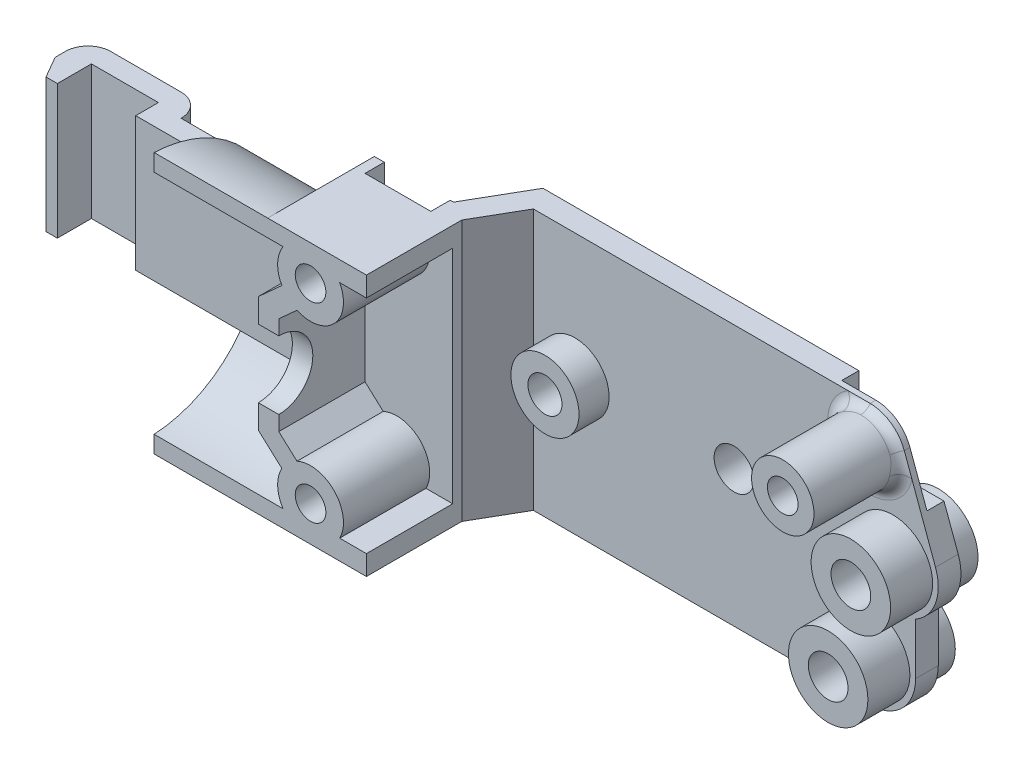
SolidWorks part; units mm, degrees
ref_plane "Front Plane" through (0, 0, 0) normal (0, 0, 1) x (1, 0, 0)
ref_plane "Top Plane" through (0, 0, 0) normal (0, 1, 0) x (1, 0, 0)
ref_plane "Right Plane" through (0, 0, 0) normal (1, 0, 0) x (0, 0, -1)
sketch "Sketch1" plane through (0, 0, 0) normal (0, 0, 1) x (1, 0, 0)
  line L0 (-4.567, -11.8) -> (25.103, -11.8)
  line L1 (29.103, -7.8) -> (29.103, -3.2641)
  line L2 (28.1084, 9.0988) -> (30.8598, 1.5735)
  line L3 (25.103, 11.2) -> (-4.567, 11.2)
  line L4 (29.103, -7.8) -> (29.103, -3.2641) construction
  line L9 (999.5524, 0.2) -> (-4.567, 0.2) construction
  line L10 (-4.567, 11.2) -> (-4.567, -11.8)
  arc A0 (29.103, -3.2641) -> (30.8598, 1.5735) centre (27.103, 0.2) ccw
  circle A2 centre (-0.897, 0.2) radius 1.5
  circle A3 centre (13.103, 0.2) radius 1.75
  circle A4 centre (27.103, 0.2) radius 1.75
  circle A5 centre (25.103, -7.8) radius 1.75
  arc A6 (25.103, -11.8) -> (29.103, -7.8) centre (25.103, -7.8) ccw
  circle A7 centre (25.103, 8) radius 1.35
  arc A9 (25.103, 11.2) -> (28.1084, 9.0988) centre (25.103, 8) cw
  circle A12 centre (-0.897, 0.2) radius 1.5 construction
  point P0 (31.103, 0.2)
  dimension "D9" = 3.5
  dimension "D10" = 3.5
  dimension "D11" = 3
  dimension "D12" = 3.5
  dimension "D13" = 2.7
  dimension "D14" = 4
  dimension "D15" = 3.2
  dimension "D19" = 4
  dimension "D3" = 35.67
  dimension "D4" = 14
  dimension "D7" = 12
  dimension "D8" = 2
  dimension "D18" = 23
  dimension "D20" = 8
  dimension "D21" = 7.8
extrude "Boss-Extrude1" add sketch "Sketch1" along normal blind 2 contours L10 L0 A6 L1 A0 L2 A9 L3 | A3 | A7 | A4 | A5
ref_plane "Plane1" through (0, -0.3, 0) normal (0, 1, 0) x (-1, 0, 0)
sketch "Sketch4" plane through (0, 0, 2) normal (0, 0, 1) x (1, 0, 0)
  circle A0 centre (27.103, 0.2) radius 3.5
  circle A1 centre (27.103, 0.2) radius 1.75 construction
  circle A2 centre (27.103, 0.2) radius 1.75
  circle A3 centre (25.103, -7.8) radius 3.5
  circle A4 centre (25.103, -7.8) radius 1.75 construction
  circle A5 centre (25.103, -7.8) radius 1.75
  dimension "D1" = 7
  dimension "D2" = 7
extrude "Boss-Extrude3" add sketch "Sketch4" along normal offset from surface (3.7 mm away) 3.7
sketch "Sketch3" plane through (0, 0, 0) normal (0, 0, -1) x (-1, 0, 0)
  circle A0 centre (-25.103, -7.8) radius 3.5
  circle A1 centre (-25.103, -7.8) radius 1.75 construction
  circle A2 centre (-25.103, -7.8) radius 1.75
  circle A3 centre (-27.103, 0.2) radius 1.75 construction
  circle A4 centre (-13.103, 0.2) radius 1.75 construction
  circle A5 centre (-27.103, 0.2) radius 1.75
  circle A6 centre (-13.103, 0.2) radius 1.75
  circle A7 centre (-27.103, 0.2) radius 3.5
  circle A8 centre (-13.103, 0.2) radius 3.5
  dimension "D1" = 7
extrude "Boss-Extrude4" add sketch "Sketch3" along normal offset from surface (2 mm away) 7.7
sketch "Sketch5" plane through (0, -0.3, 0) normal (0, 1, 0) x (1, 0, 0)
  line L0 (-6.8764, -6.8) -> (-6.8764, -6)
  line L1 (-6.8764, -6.8) -> (-34.8, -6.8)
  line L2 (-34.8, -6.8) -> (-34.8, -4.8)
  line L3 (-34.8, -4.8) -> (-40.703, -4.8)
  line L4 (-40.703, -4.8) -> (-40.703, -7.8)
  line L5 (-40.703, -7.8) -> (-41.703, -7.8)
  line L6 (-41.703, -7.8) -> (-42.8, -5.9)
  line L7 (-42.8, -5.9) -> (-42.8, -3)
  line L9 (-42.8, -3) -> (-32.6, -3)
  line L10 (-32.6, -3) -> (-32.6, -5)
  line L11 (-32.6, -5) -> (-8.6085, -5)
  line L12 (-4.567, 0) -> (-5.7217, 0)
  line L13 (-4.567, -2) -> (-4.567, 0) construction
  line L14 (-4.567, -2) -> (-4.567, 0)
  line L15 (-6.8764, -6) -> (-4.567, -2)
  line L16 (-5.7217, 0) -> (-8.6085, -5)
  line L17 (25.103, 0) -> (-4.567, 0) construction
  dimension "D1" = 2
  dimension "D2" = 3
  dimension "D3" = 1
  dimension "D4" = 1.9
  dimension "D5" = 1.8
  dimension "D6" = 120
  dimension "D7" = 5
  dimension "D8" = 2
  dimension "D9" = 1.8
  dimension "D10" = 34.8
  dimension "D11" = 2.2
  dimension "D12" = 8
  dimension "D13" = 1
  dimension "D14" = 120
extrude "Boss-Extrude5" add sketch "Sketch5" along normal mid plane 11.8
fillet "Fillet1" radius 2 2 edges at (-32.6, -0.3, 3) (-42.8, -0.3, 3)
sketch "Sketch6" plane through (0, 0, 2) normal (0, 0, 1) x (1, 0, 0)
  circle A0 centre (25.103, 8) radius 1.35 construction
  circle A1 centre (25.103, 8) radius 1.35
  circle A2 centre (25.103, 8) radius 2.75
  dimension "D1" = 5.5
extrude "Boss-Extrude6" add sketch "Sketch6" along normal blind 7.7
sketch "Sketch8" plane through (0, 0, 2) normal (0, 0, 1) x (1, 0, 0)
  circle A0 centre (-0.897, 0.2) radius 3
  circle A1 centre (-0.897, 0.2) radius 1.5 construction
  circle A2 centre (-0.897, 0.2) radius 1.5
  dimension "D1" = 6
extrude "Boss-Extrude7" add sketch "Sketch8" along normal blind 2.65
sketch "Sketch9" plane through (0, -0.3, 0) normal (0, -1, 0) x (1, 0, 0)
  line L0 (-5.7217, 0) -> (-8.6085, 5) construction
  line L1 (-4.567, 0) -> (-5.7217, 0) construction
  line L2 (-6.8764, 6) -> (-4.567, 2) construction
  line L3 (-4.567, 2) -> (-4.567, 0) construction
  line L4 (-6.8764, 6.8) -> (-6.8764, 6) construction
  line L5 (-5.7217, 0) -> (-8.6085, 5)
  line L6 (-4.567, 0) -> (-5.7217, 0)
  line L7 (-6.8764, 6) -> (-4.567, 2)
  line L8 (-4.567, 2) -> (-4.567, 0)
  line L9 (-6.8764, 6.8) -> (-6.8764, 6)
  line L10 (-8.6085, 5) -> (-8.6085, 6.8)
  line L11 (-34.8, 6.8) -> (-6.8764, 6.8) construction
  line L12 (-8.6085, 6.8) -> (-6.8764, 6.8)
extrude "Boss-Extrude10" add sketch "Sketch9" along normal mid plane 23
sketch "Sketch10" plane through (0, 0, 5) normal (0, 0, -1) x (-1, 0, 0)
  line L0 (25.5764, -11.8) -> (6.8764, -11.8)
  line L1 (6.8764, -11.8) -> (6.8764, -10.05)
  line L2 (6.8764, -10.05) -> (9.2304, -10.05)
  line L3 (12.9925, -6.0579) -> (14.597, -4.6025)
  line L4 (14.597, -4.6025) -> (14.597, 4.0025)
  line L5 (16.397, 4.8) -> (16.397, -5.4)
  line L6 (16.397, -5.4) -> (14.3251, -7.2792)
  line L7 (14.0708, -10.5) -> (25.5764, -10.5)
  line L8 (25.5764, -10.5) -> (25.5764, -11.8)
  line L9 (25.5764, 9.9) -> (25.5764, 11.2)
  line L10 (14.0708, 9.9) -> (25.5764, 9.9)
  line L11 (16.397, 4.8) -> (14.3251, 6.6792)
  line L12 (-8.6455, -0.3) -> (-5.3863, -0.3) construction
  line L13 (-25.103, 11.2) -> (4.567, 11.2) construction
  line L14 (12.9925, 5.4579) -> (14.597, 4.0025)
  line L15 (6.8764, 9.45) -> (9.2304, 9.45)
  line L16 (6.8764, 11.2) -> (6.8764, 9.45)
  line L17 (25.5764, 11.2) -> (6.8764, 11.2)
  line L20 (8.6085, 11.2) -> (6.8764, 11.2) construction
  line L21 (8.6085, -11.8) -> (6.8764, -11.8) construction
  line L22 (4.567, -11.8) -> (-25.103, -11.8) construction
  line L23 (6.8764, 11.2) -> (6.8764, -11.8) construction
  line L24 (6.8764, 11.2) -> (6.8764, -11.8) construction
  line L25 (16.397, 4.8) -> (16.397, 2.7) construction
  arc A0 (9.2304, -10.05) -> (12.9925, -6.0579) centre (11.797, -8.7) cw
  arc A1 (14.3251, -7.2792) -> (14.0708, -10.5) centre (11.797, -8.7) cw
  arc A2 (14.3251, 6.6792) -> (14.0708, 9.9) centre (11.797, 8.1) ccw
  arc A3 (9.2304, 9.45) -> (12.9925, 5.4579) centre (11.797, 8.1) ccw
  circle A4 centre (11.797, 8.1) radius 1.35
  circle A5 centre (11.797, -8.7) radius 1.35
  dimension "D1" = 2.9
  dimension "D14" = 2.7
  dimension "D11" = 10.9
  dimension "D2" = 1.3
  dimension "D3" = 1.8
  dimension "D4" = 18.7
  dimension "D5" = 1.8
  dimension "D6" = 10.2
  dimension "D7" = 1.3
  dimension "D8" = 1.75
  dimension "D9" = 3.1
  dimension "D10" = 3.1
  dimension "D12" = 1.8
extrude "Boss-Extrude11" add sketch "Sketch10" against normal offset from surface (9.4 mm away) 7.6
sketch "Sketch11" plane through (0, 0, 5) normal (0, 0, -1) x (-1, 0, 0)
  line L0 (25.5764, 11.2) -> (8.6085, 11.2) construction
  line L1 (8.6085, -11.8) -> (17.0924, -11.8)
  line L2 (8.6085, -11.8) -> (8.6085, 11.2)
  line L3 (8.6085, 11.2) -> (17.0924, 11.2)
  line L4 (17.0924, -11.8) -> (17.0924, 11.2)
  circle A0 centre (11.797, 8.1) radius 1.35 construction
  circle A1 centre (11.797, -8.7) radius 1.35 construction
  circle A2 centre (11.797, 8.1) radius 1.35
  circle A3 centre (11.797, -8.7) radius 1.35
extrude "Boss-Extrude12" add sketch "Sketch11" against normal up to surface (1.8 mm away)
sketch "Sketch13" plane through (0, 0, 0) normal (0, 0, -1) x (-1, 0, 0)
  line L0 (-29.607, 5) -> (-25.103, 5)
  line L1 (-28.1084, 9.0988) -> (-30.8598, 1.5735) construction
  line L2 (-22.103, 8) -> (-22.103, 11.2)
  line L3 (-25.103, 11.2) -> (5.7217, 11.2) construction
  line L4 (-28.1084, 9.0988) -> (-29.607, 5)
  line L5 (-25.103, 11.2) -> (-22.103, 11.2)
  arc A0 (-25.103, 5) -> (-22.103, 8) centre (-25.103, 8) ccw
  circle A1 centre (-25.103, 8) radius 1.35 construction
  arc A2 (-25.103, 11.2) -> (-28.1084, 9.0988) centre (-25.103, 8) ccw construction
  arc A3 (-25.103, 11.2) -> (-28.1084, 9.0988) centre (-25.103, 8) ccw
  dimension "D1" = 3
extrude "Cut-Extrude3" cut sketch "Sketch13" against normal blind 1.5
fillet "Fillet2" radius 1 1 edges at (27.853, 8, 2)
sketch "Sketch14" plane through (-25.5764, 0, 0) normal (-1, 0, 0) x (0, 0, 1)
  line L2 (5, 5.6) -> (6.8, 5.6) construction
  line L3 (14.4, 8.1579) -> (14.4, -49991.8421) construction
  line L7 (14.4, 9.6956) -> (14.4, 11.2)
  line L8 (6.8, 5.6) -> (5, 5.6)
  line L9 (5, -6.2) -> (6.8, -6.2)
  line L10 (14.4, -10.2956) -> (14.4, -11.8)
  arc A0 (14.4, 11.2) -> (5, 5.6) centre (14.883, -0.3) ccw
  arc A1 (14.4, 9.6956) -> (6.8, 5.6) centre (14.883, -0.3) ccw
  arc A2 (5, -6.2) -> (14.4, -11.8) centre (14.883, -0.3) ccw
  arc A3 (6.8, -6.2) -> (14.4, -10.2956) centre (14.883, -0.3) ccw
  dimension "D1" = 1.8
  dimension "D2" = 1.5044
extrude "Boss-Extrude14" add sketch "Sketch14" against normal up to vertex (8.484 mm away)
sketch "Sketch12" plane through (0, 0, 5) normal (0, 0, -1) x (-1, 0, 0)
  line L0 (8.897, -11.8) -> (8.897, -8.7)
  line L1 (8.6085, -11.8) -> (25.5764, -11.8) construction
  line L2 (14.697, -8.7) -> (14.697, -11.8)
  line L3 (14.697, -11.8) -> (8.897, -11.8)
  arc A0 (8.897, -8.7) -> (14.697, -8.7) centre (11.797, -8.7) cw
  arc A1 (12.9925, -6.0579) -> (9.2304, -10.05) centre (11.797, -8.7) ccw construction
extrude "Cut-Extrude1" cut sketch "Sketch12" against normal blind 1.7
mirror "Mirror1" about plane through (0, -0.3, 0) normal (0, 1, 0) of "Cut-Extrude1"
sketch "Sketch17" plane through (0, 0, 5) normal (0, 0, -1) x (-1, 0, 0)
  line L0 (15.197, 11.2) -> (15.197, 6.7766)
  line L1 (25.5764, 11.2) -> (14.697, 11.2) construction
  line L2 (15.197, 6.7766) -> (16.197, 6.7766)
  line L3 (16.197, 6.7766) -> (16.197, 11.2)
  line L4 (15.197, 11.2) -> (16.197, 11.2)
  line L5 (14.697, 11.2) -> (14.697, 8.1) construction
  dimension "D1" = 0.5
  dimension "D2" = 1
extrude "Boss-Extrude15" add sketch "Sketch17" against normal up to surface (9.4 mm away)
sketch "Sketch18" plane through (-25.5764, 0, 0) normal (-1, 0, 0) x (0, 0, 1)
  line L0 (14.4, 11.2) -> (5, 11.2) construction
  line L3 (14.4, 11.2) -> (5, 11.2)
  line L4 (5, 11.2) -> (5, 5.6)
  line L5 (5, 5.6) -> (5, 9.9) construction
  arc A0 (14.4, 11.2) -> (5, 5.6) centre (14.883, -0.3) ccw
  arc A2 (9.5498, 9.9) -> (5, 5.6) centre (14.883, -0.3) ccw construction
extrude "Cut-Extrude5" cut sketch "Sketch18" against normal blind 10
sketch "Sketch19" plane through (0, 0, 5) normal (0, 0, -1) x (-1, 0, 0)
  line L0 (14.697, -11.8) -> (25.5764, -11.8) construction
  line L1 (15.197, -11.8) -> (16.697, -11.8)
  line L2 (15.197, -11.8) -> (15.197, -5.8923)
  line L3 (15.197, -5.8923) -> (16.697, -5.8923)
  line L4 (16.697, -11.8) -> (16.697, -5.8923)
  line L5 (14.697, -11.8) -> (14.697, -8.7) construction
  dimension "D1" = 0.5
  dimension "D2" = 1.5
extrude "Boss-Extrude16" add sketch "Sketch19" against normal up to surface (9.4 mm away)
sketch "Sketch20" plane through (-25.5764, 0, 0) normal (-1, 0, 0) x (0, 0, 1)
  line L0 (14.4, -11.8) -> (5, -11.8) construction
  line L1 (14.4, -11.8) -> (5, -11.8)
  line L2 (5, -6.2) -> (5, -11.8)
  arc A0 (5, -6.2) -> (14.4, -11.8) centre (14.883, -0.3) ccw
  arc A1 (5, -6.2) -> (9.5498, -10.5) centre (14.883, -0.3) ccw construction
extrude "Cut-Extrude6" cut sketch "Sketch20" against normal up to surface (10 mm away)
sketch "Sketch21" plane through (-16.397, 0, 0) normal (-1, 0, 0) x (0, 0, 1)
  line L0 (14.4, 4.8) -> (14.4, -5.4) construction
  circle A0 centre (14.4, -0.3) radius 3
  dimension "D1" = 6
extrude "Cut-Extrude7" cut sketch "Sketch21" against normal up to next
sketch "Sketch22" plane through (0, -11.8, 0) normal (0, -1, 0) x (1, 0, 0)
  line L0 (0.812, 0) -> (3.5255, -4.7)
  line L1 (-5.7217, 0) -> (25.103, 0) construction
  line L2 (8.7217, -4.7) -> (11.4352, 0)
  line L3 (9.603, 0) -> (16.603, 0) construction
  line L4 (0.812, 0) -> (4.6236, 0)
  line L5 (4.6236, -3.2) -> (4.6236, 0)
  line L6 (7.6236, 0) -> (11.4352, 0)
  line L7 (7.6236, 0) -> (7.6236, -3.2)
  arc A0 (3.5255, -4.7) -> (8.7217, -4.7) centre (6.1236, -3.2) ccw
  arc A1 (4.6236, -3.2) -> (7.6236, -3.2) centre (6.1236, -3.2) ccw
  point P11 (6.1236, -6.2)
  dimension "D2" = 3
  dimension "D3" = 6.2
  dimension "D5" = 1.5
  dimension "D1" = 120
  dimension "D4" = 13
extrude "Boss-Extrude17" add sketch "Sketch22" against normal blind 2
